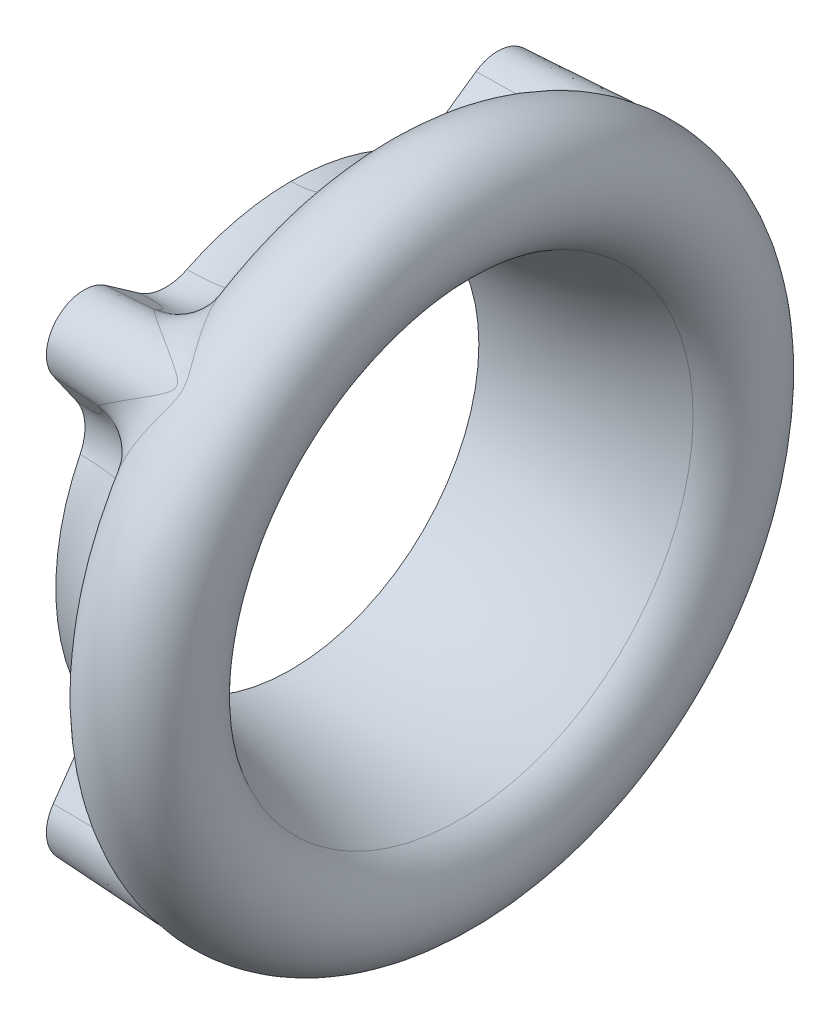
SolidWorks part; units mm, degrees
ref_plane "Front Plane" through (0, 0, 0) normal (0, 0, 1) x (1, 0, 0)
ref_plane "Top Plane" through (0, 0, 0) normal (0, 1, 0) x (1, 0, 0)
ref_plane "Right Plane" through (0, 0, 0) normal (1, 0, 0) x (0, 0, -1)
sketch "Sketch1" plane through (0, 0, 0) normal (1, 0, 0) x (0, 0, -1)
  line L0 (-1.5, 0) -> (1.5, 0) construction
  line L1 (-1.5, 17) -> (1.5, 17) construction
  line L2 (-1.5, -17) -> (1.5, -17) construction
  line L3 (0, 17) -> (0, 20) construction
  arc A0 (-1.5, 17) -> (-1.5, -17) centre (-1.5, 0) ccw construction
  arc A1 (1.5, -17) -> (1.5, 17) centre (1.5, 0) ccw construction
  circle A2 centre (0, 0) radius 20
  point P2 (0, 0)
  dimension "D1" = 17
  dimension "D3" = 40
  dimension "D2" = 3
sketch "Sketch2" plane through (0, 0, 0) normal (0, 0, 1) x (1, 0, 0)
  line L0 (0, -17) -> (0, 17) construction
  line L1 (0, -17) -> (0, 17) construction
  line L2 (0, 20) -> (-4.2742, 20) construction
  line L3 (0, 20) -> (0, 25)
  line L4 (0, 25) -> (-6.6696, 25) construction
  line L5 (15, 30) -> (-4.6358, 30) construction
  line L6 (0, 0) -> (17.5192, 0) construction
  arc A0 (17.9876, 24.7967) -> (9.2775, 31.8035) centre (15, 30) ccw
  arc A1 (17.9876, 24.7967) -> (0, 20) centre (0, 56.125) cw
  arc A4 (9.2775, 31.8035) -> (0, 25) centre (0, 34.7273) cw
  point P5 (0, 0)
  dimension "D3" = 12
  dimension "D1" = 15
  dimension "D2" = 5
  dimension "D4" = 5
sweep "Sweep1" add profiles "Sketch2" path "Sketch1"
sketch "Sketch6" plane through (0, 0, 0) normal (1, 0, 0) x (0, 0, -1)
  line L1 (22, 22) -> (-22, 22)
  line L2 (22, 22) -> (22, -22)
  line L3 (22, -22) -> (-22, -22)
  line L4 (-22, 22) -> (-22, -22)
  line L5 (22, 22) -> (-22, -22) construction
  line L6 (22, -22) -> (-22, 22) construction
  point P0 (0, 0)
  dimension "D1" = 44
  dimension "D2" = 44
sketch "Sketch7" plane through (0, 0, 0) normal (1, 0, 0) x (0, 0, -1)
  line L0 (25.2766, 19.7057) -> (19.4305, 11.3565)
  line L1 (19.4305, 11.3565) -> (11.3565, 19.4305)
  line L2 (11.3565, 19.4305) -> (19.7057, 25.2766)
  line L3 (22, 22) -> (-22, -22) construction
  line L4 (-22, 22) -> (22, -22) construction
  line L5 (-19.7057, 25.2766) -> (-11.9104, 19.8183)
  line L6 (-11.9104, 19.8183) -> (-19.8183, 11.9104)
  line L7 (-19.8183, 11.9104) -> (-25.2766, 19.7057)
  line L8 (-25.2766, -19.7057) -> (-19.4454, -11.3778)
  line L9 (-19.4454, -11.3778) -> (-11.3778, -19.4454)
  line L10 (-11.3778, -19.4454) -> (-19.7057, -25.2766)
  line L11 (25.2766, -19.7057) -> (19.817, -11.9086)
  line L12 (19.817, -11.9086) -> (11.9086, -19.817)
  line L13 (11.9086, -19.817) -> (19.7057, -25.2766)
  arc A0 (25.2766, 19.7057) -> (19.7057, 25.2766) centre (22, 22) ccw
  arc A1 (-19.7057, 25.2766) -> (-25.2766, 19.7057) centre (-22, 22) ccw
  arc A2 (-25.2766, -19.7057) -> (-19.7057, -25.2766) centre (-22, -22) ccw
  arc A3 (19.7057, -25.2766) -> (25.2766, -19.7057) centre (22, -22) ccw
  dimension "D1" = 8
  dimension "D2" = 10
  dimension "D3" = 10
  dimension "D4" = 10
  dimension "D5" = 10
extrude "Boss-Extrude1" add sketch "Sketch7" along normal blind 15 draft 3
other "DeleteFace1"
hole_wizard "M5 Tapped Hole2" positions "Sketch8" profile "Sketch9" tap size "M5" standard "ISO"
sketch "Sketch8" plane through (0, 0, 0) normal (-1, 0, 0) x (0, 0, 1)
  point P0 (-22, 22)
  point P3 (22, 22)
  point P6 (22, -22)
  point P9 (-22, -22)
sketch "Sketch9" plane through (0, 22, -22) normal (0, 1, 0) x (0, 0, 1)
  line L0 (0, 0) -> (0, 13.6618)
  line L1 (0, 13.6618) -> (2.1, 12.4)
  line L2 (2.1, 12.4) -> (2.1, 0)
  line L5 (2.1, 0) -> (0, 0)
  line L10 (0, 13.6618) -> (-2.1, 12.4) construction
  line L11 (0, -6.35) -> (0, 107.95) construction
  dimension "Tap Drill Dia." = 4.2
  dimension "Tap Drill Depth" = 12.4
  dimension "Drill Angle" = 118
fillet "Fillet1" radius 5 20 edges at (6.2604, -15.2972, -22.5903) (13.5527, -25.3038, -25.3573) (5.3384, 14.7373, -22.1393) (13.5527, 25.3573, -25.3038) (5.3384, 22.1393, 14.7373) (13.5527, 25.3038, 25.3573) (6.2604, -22.5903, 15.2972) (13.5527, -25.3573, 25.3038) (5.3384, -22.1393, -14.7373) (6.2604, 22.5903, -15.2972) (6.2604, 15.2972, 22.5903) (5.3384, -14.7373, 22.1393)
